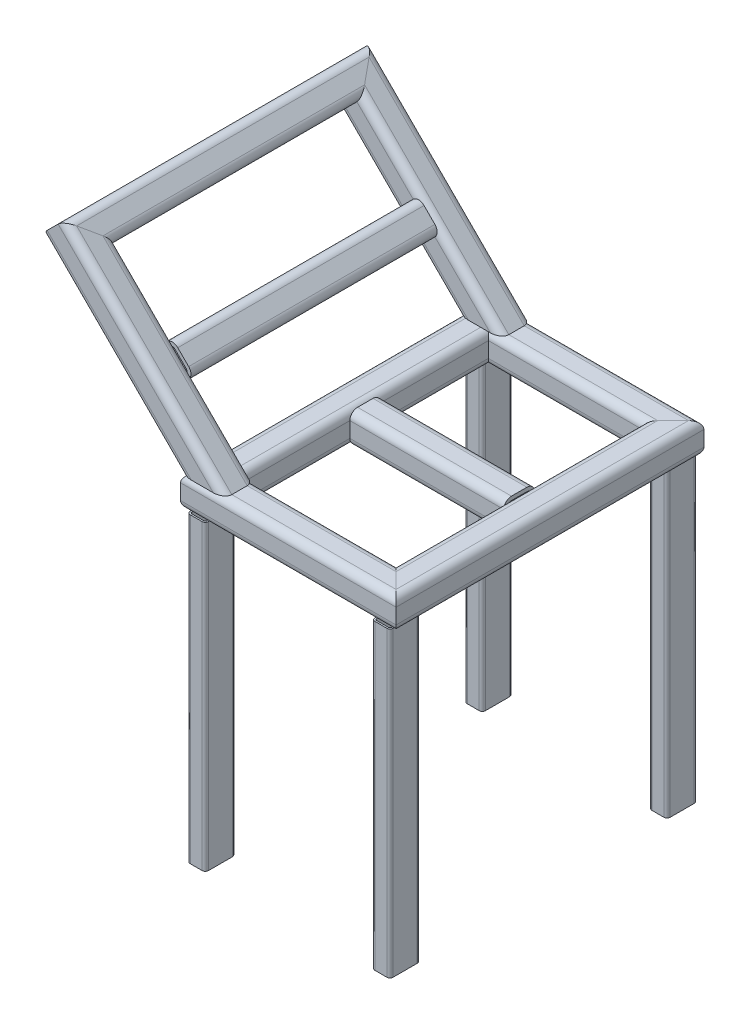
SolidWorks part; units mm, degrees
ref_plane "Front Plane" through (0, 0, 0) normal (0, 0, 1) x (1, 0, 0)
ref_plane "Top Plane" through (0, 0, 0) normal (0, 1, 0) x (1, 0, 0)
ref_plane "Right Plane" through (0, 0, 0) normal (1, 0, 0) x (0, 0, -1)
sketch "Sketch1"
  dimension "D1" = 304.8
  dimension "D2" = 457.2
sketch3d "3DSketch1"
  dimension "D1" = 155.9133
  dimension "D4" = 304.8
  dimension "D2" = 135
  dimension "D3" = 152.4
sketch "Sketch2"
  dimension "D1" = 457.2
ref_plane "Plane1" through (0, 0, 457.2) normal (0, 0, 1) x (1, 0, 0)
sketch "Sketch3"
  dimension "D1" = 457.2
  dimension "D2" = 12
other "Structural Member1"
ref_plane "Plane5" through (-236.5289, 236.5289, 457.2) normal (0.7071, -0.7071, 0) x (0, 0, -1)
sketch "Sketch111"
  dimension "D1" = 12.7
  dimension "D2" = 4.7625
  dimension "D3" = 6.604
  dimension "D4" = 41.275
  dimension "D5" = 41.275
  dimension "D6" = 4.7625
  dimension "D7" = 6.35
  dimension "D8" = 6.35
  dimension "Thickness" = 6.35
  dimension "V_leg" = 50.8
  dimension "H_leg" = 50.8
other "Structural Member2"
ref_plane "Plane6" through (0, 0, 457.2) normal (1, 0, 0) x (0, 0, -1)
sketch "Sketch15"
  dimension "D1" = 12.7
  dimension "D2" = 4.7625
  dimension "D3" = 6.604
  dimension "D4" = 41.275
  dimension "D5" = 41.275
  dimension "D6" = 4.7625
  dimension "D7" = 6.35
  dimension "D8" = 6.35
  dimension "Thickness" = 6.35
  dimension "V_leg" = 50.8
  dimension "H_leg" = 50.8
other "Trim/Extend2"
sketch3d "3DSketch2"
other "Structural Member3"
ref_plane "Plane7" through (304.8, -25.4, 457.2) normal (0, -1, 0) x (0.9986, 0, 0.052)
sketch "Sketch113"
  dimension "D1" = 5.2
  dimension "D2" = 4.7625
  dimension "D3" = 6.604
  dimension "D4" = 41.275
  dimension "D5" = 41.275
  dimension "D6" = 4.7625
  dimension "D7" = 6.35
  dimension "D8" = 6.35
  dimension "Thickness" = 2.6
  dimension "V_leg" = 50
  dimension "H_leg" = 30
sketch3d "3DSketch3"
other "Structural Member4"
ref_plane "Plane8" through (304.8, -25.4, 0) normal (0, -1, 0) x (1, 0, 0)
sketch "Sketch114"
  dimension "D1" = 5.2
  dimension "D2" = 4.7625
  dimension "D3" = 6.604
  dimension "D4" = 41.275
  dimension "D5" = 41.275
  dimension "D6" = 4.7625
  dimension "D7" = 6.35
  dimension "D8" = 6.35
  dimension "Thickness" = 2.6
  dimension "V_leg" = 50
  dimension "H_leg" = 30
other "Trim/Extend4"
